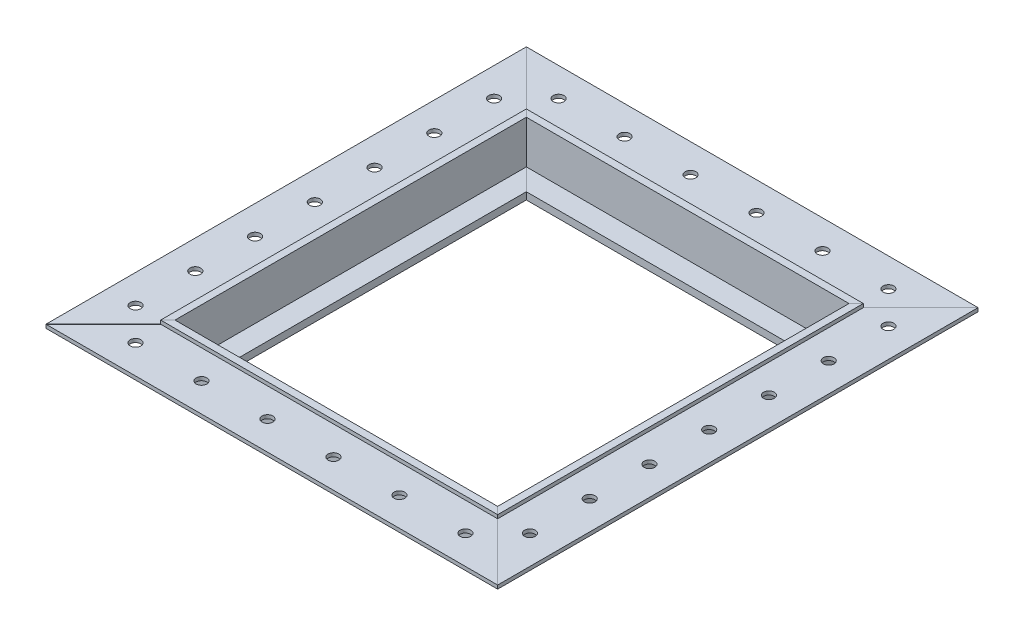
SolidWorks part; units mm, degrees
ref_plane "Front Plane" through (0, 0, 0) normal (0, 0, 1) x (1, 0, 0)
ref_plane "Top Plane" through (0, 0, 0) normal (0, 1, 0) x (1, 0, 0)
ref_plane "Right Plane" through (0, 0, 0) normal (1, 0, 0) x (0, 0, -1)
sketch "Sketch1" plane through (0, 0, 0) normal (0, 0, 1) x (1, 0, 0)
  line L0 (0, 0) -> (-12.7, 0)
  line L1 (-12.7, 0) -> (-12.7, 19.05)
  line L2 (-12.7, 19.05) -> (-38.1, 19.05)
  line L3 (-38.1, 19.05) -> (-38.1, 20.6375)
  line L4 (-38.1, 20.6375) -> (-12.7, 20.6375)
  line L5 (-12.7, 20.6375) -> (-12.7, 22.225)
  line L6 (-12.7, 22.225) -> (-9.525, 22.225)
  line L7 (-9.525, 22.225) -> (-9.525, 3.175)
  line L8 (-9.525, 3.175) -> (0, 3.175)
  line L9 (0, 3.175) -> (0, 0)
  line L10 (0, 0) -> (0.1482, 0.0676)
  line L11 (-9.525, 22.225) -> (133.35, 22.225) construction
  line L12 (61.9125, 22.225) -> (61.9125, -3.6466) construction
  line L13 (123.825, 0) -> (123.6768, 0.0676)
  line L14 (123.825, 3.175) -> (123.825, 0)
  line L15 (133.35, 3.175) -> (123.825, 3.175)
  line L16 (133.35, 22.225) -> (133.35, 3.175)
  line L17 (136.525, 22.225) -> (133.35, 22.225)
  line L18 (136.525, 20.6375) -> (136.525, 22.225)
  line L19 (161.925, 20.6375) -> (136.525, 20.6375)
  line L20 (161.925, 19.05) -> (161.925, 20.6375)
  line L21 (136.525, 19.05) -> (161.925, 19.05)
  line L22 (136.525, 0) -> (136.525, 19.05)
  line L23 (123.825, 0) -> (136.525, 0)
  dimension "D1" = 12.7
  dimension "D2" = 19.05
  dimension "D3" = 25.4
  dimension "D4" = 1.5875
  dimension "D5" = 22.225
  dimension "D6" = 3.175
  dimension "D7" = 3.175
  dimension "D8" = 142.875
sketch "Sketch2" plane through (0, 0, 0) normal (0, 1, 0) x (1, 0, 0)
  line L0 (-9.525, 0) -> (133.35, 0) construction
  line L1 (150.8125, -47.625) -> (-26.9875, -47.625)
  line L2 (150.8125, -47.625) -> (150.8125, 47.625)
  line L3 (150.8125, 47.625) -> (-26.9875, 47.625)
  line L4 (-26.9875, -47.625) -> (-26.9875, 47.625)
  line L5 (150.8125, -47.625) -> (-26.9875, 47.625) construction
  line L6 (150.8125, 47.625) -> (-26.9875, -47.625) construction
  point P0 (61.9125, 0)
  dimension "D1" = 177.8
  dimension "D2" = 95.25
extrude "Boss-Extrude1" add sketch "Sketch1" along normal mid plane 155.575 contours L14 L23 L22 L21 L20 L19 L18 L17 L16 L15 | L0 L1 L2 L3 L4 L5 L6 L7 L8 L9
ref_plane "Plane2" through (61.9125, 0, 0) normal (-1, 0, 0) x (0, 0, 1)
sketch "Sketch3" plane through (61.9125, 0, 0) normal (-1, 0, 0) x (0, 0, 1)
  line L0 (-68.2625, 0) -> (-80.9625, 0)
  line L1 (-80.9625, 0) -> (-80.9625, 19.05)
  line L2 (-80.9625, 19.05) -> (-106.3625, 19.05)
  line L3 (-106.3625, 19.05) -> (-106.3625, 20.6375)
  line L4 (-106.3625, 20.6375) -> (-80.9625, 20.6375)
  line L5 (-80.9625, 20.6375) -> (-80.9625, 22.225)
  line L6 (-80.9625, 22.225) -> (-77.7875, 22.225)
  line L7 (-77.7875, 22.225) -> (-77.7875, 3.175)
  line L8 (-77.7875, 3.175) -> (-68.2625, 3.175)
  line L9 (-68.2625, 3.175) -> (-68.2625, 0)
  line L11 (0, 22.225) -> (0, -35.0713) construction
  line L12 (77.7875, 22.225) -> (-77.7875, 22.225) construction
  line L13 (68.2625, 0) -> (68.1143, 0.0676)
  line L14 (68.2625, 3.175) -> (68.2625, 0)
  line L15 (77.7875, 3.175) -> (68.2625, 3.175)
  line L16 (77.7875, 22.225) -> (77.7875, 3.175)
  line L17 (80.9625, 22.225) -> (77.7875, 22.225)
  line L18 (80.9625, 20.6375) -> (80.9625, 22.225)
  line L19 (106.3625, 20.6375) -> (80.9625, 20.6375)
  line L20 (106.3625, 19.05) -> (106.3625, 20.6375)
  line L21 (80.9625, 19.05) -> (106.3625, 19.05)
  line L22 (80.9625, 0) -> (80.9625, 19.05)
  line L23 (68.2625, 0) -> (80.9625, 0)
  dimension "D1" = 12.7
  dimension "D2" = 19.05
  dimension "D3" = 25.4
  dimension "D4" = 1.5875
  dimension "D5" = 22.225
  dimension "D6" = 3.175
  dimension "D7" = 3.175
  dimension "D8" = 77.7875
extrude "Boss-Extrude2" add sketch "Sketch3" along normal mid plane 200.025 contours L9 L8 L7 L6 L5 L4 L3 L2 L1 L0 | L14 L23 L22 L21 L20 L19 L18 L17 L16 L15
sketch "Sketch4" plane through (0, 20.6375, 0) normal (0, 1, 0) x (1, 0, 0)
  line L0 (-38.1, -106.3625) -> (161.925, -106.3625) construction
  line L1 (161.925, 106.3625) -> (136.525, 106.3625)
  line L2 (161.925, 106.3625) -> (161.925, -106.3625)
  line L3 (161.925, -106.3625) -> (136.525, -106.3625)
  line L4 (136.525, 106.3625) -> (136.525, -106.3625)
  line L5 (-38.1, 106.3625) -> (161.925, 106.3625) construction
  line L6 (-38.1, -106.3625) -> (-12.7, -106.3625)
  line L7 (-38.1, -106.3625) -> (-38.1, 106.3625)
  line L8 (-38.1, 106.3625) -> (-12.7, 106.3625)
  line L9 (-12.7, -106.3625) -> (-12.7, 106.3625)
  line L10 (136.525, -77.7875) -> (136.525, 77.7875) construction
  line L11 (161.925, -77.7875) -> (161.925, 77.7875) construction
  line L12 (-38.1, -106.3625) -> (161.925, -106.3625) construction
  line L13 (-12.7, -77.7875) -> (-12.7, 77.7875) construction
  line L14 (-38.1, 106.3625) -> (161.925, 106.3625) construction
  line L15 (-38.1, -77.7875) -> (-38.1, 77.7875) construction
extrude "Cut-Extrude1" cut sketch "Sketch4" along normal blind 158.75
sketch "Sketch5" plane through (0, 0, 80.9625) normal (0, 0, 1) x (1, 0, 0)
  line L1 (-38.1, 19.05) -> (-12.7, 19.05)
  line L2 (-38.1, 19.05) -> (-38.1, 0)
  line L3 (-38.1, 0) -> (-12.7, 0)
  line L4 (-12.7, 19.05) -> (-12.7, 0)
  line L5 (136.525, 0) -> (161.925, 0)
  line L6 (136.525, 0) -> (136.525, 19.05)
  line L7 (136.525, 19.05) -> (161.925, 19.05)
  line L8 (161.925, 0) -> (161.925, 19.05)
extrude "Cut-Extrude2" cut sketch "Sketch5" against normal through all
sketch "Sketch14" plane through (0, 22.225, 0) normal (0, 1, 0) x (1, 0, 0)
  line L0 (-9.525, -77.7875) -> (133.35, -77.7875) construction
  line L1 (133.35, -77.7875) -> (133.35, 77.7875) construction
  line L2 (-9.525, 77.7875) -> (133.35, 77.7875) construction
  line L3 (-9.525, -77.7875) -> (-9.525, 77.7875) construction
  line L4 (-12.7, 80.9625) -> (-12.7, -80.9625)
  line L5 (-12.7, -80.9625) -> (136.525, -80.9625)
  line L6 (136.525, -80.9625) -> (136.525, 80.9625)
  line L7 (136.525, 80.9625) -> (-12.7, 80.9625)
  line L8 (-12.7, 80.9625) -> (-12.7, -80.9625)
  line L9 (-12.7, -80.9625) -> (136.525, -80.9625)
  line L10 (136.525, -80.9625) -> (136.525, 80.9625)
  line L11 (136.525, 80.9625) -> (-12.7, 80.9625)
  line L12 (-9.525, -77.7875) -> (133.35, -77.7875)
  line L13 (133.35, -77.7875) -> (133.35, 77.7875)
  line L14 (-9.525, 77.7875) -> (133.35, 77.7875)
  line L15 (-9.525, -77.7875) -> (-9.525, 77.7875)
  line L16 (-11.1125, -79.375) -> (-11.1125, 79.375)
  line L17 (-11.1125, 79.375) -> (134.9375, 79.375)
  line L18 (134.9375, -79.375) -> (134.9375, 79.375)
  line L19 (-11.1125, -79.375) -> (134.9375, -79.375)
  dimension "D2" = 1.5875
  dimension "D1" = 0
sketch "Sketch6" plane through (0, 22.225, 0) normal (0, 1, 0) x (1, 0, 0)
  line L0 (161.925, 106.3625) -> (123.825, 68.2625) construction
  line L1 (0, 0) -> (186.3821, 0) construction
  line L2 (61.9125, 106.3625) -> (61.9125, 211.7305) construction
  line L3 (-38.1, 106.3625) -> (161.925, 106.3625) construction
  line L4 (161.907, 106.3805) -> (114.639, 59.1124)
  line L5 (161.943, 106.3445) -> (115.0327, 59.4343)
  line L6 (114.639, 59.1124) -> (115.0327, 59.4343)
  line L7 (161.907, 106.3805) -> (123.807, 68.2805) construction
  line L8 (161.943, 106.3445) -> (123.843, 68.2445) construction
  line L9 (161.907, 106.3805) -> (161.943, 106.3445)
  line L10 (-38.1, 106.3625) -> (0, 68.2625) construction
  line L11 (-38.082, 106.3805) -> (-38.118, 106.3445)
  line L12 (9.186, 59.1124) -> (8.7923, 59.4343)
  line L13 (-38.118, 106.3445) -> (8.7923, 59.4343)
  line L14 (-38.082, 106.3805) -> (9.186, 59.1124)
  line L15 (-38.1, -106.3625) -> (0, -68.2625) construction
  line L16 (61.9125, -106.3625) -> (61.9125, -211.7305) construction
  line L17 (161.925, -106.3625) -> (123.825, -68.2625) construction
  line L18 (-38.082, -106.3805) -> (9.186, -59.1124)
  line L19 (-38.118, -106.3445) -> (8.7923, -59.4343)
  line L20 (9.186, -59.1124) -> (8.7923, -59.4343)
  line L21 (-38.082, -106.3805) -> (-38.118, -106.3445)
  line L22 (161.907, -106.3805) -> (161.943, -106.3445)
  line L23 (114.639, -59.1124) -> (115.0327, -59.4343)
  line L24 (161.943, -106.3445) -> (115.0327, -59.4343)
  line L25 (161.907, -106.3805) -> (114.639, -59.1124)
  dimension "D3" = 1.27
  dimension "D4" = 0.5085
  dimension "D1" = 0.0254
  dimension "D2" = 0.0254
extrude "Cut-Extrude3" cut sketch "Sketch6" against normal through all
sketch "Sketch7" plane through (0, 20.6375, 0) normal (0, 1, 0) x (1, 0, 0)
  line L0 (-38.1, 106.3266) -> (-38.1, 106.3625) construction
  line L1 (-38.1, 106.3625) -> (-38.0641, 106.3625) construction
  line L2 (161.8891, -106.3625) -> (161.925, -106.3625) construction
  line L3 (161.925, -106.3266) -> (161.925, -106.3625) construction
  line L4 (149.225, 93.6625) -> (-25.4, 93.6625) construction
  line L5 (161.925, -106.3625) -> (-38.1, -106.3625) construction
  line L6 (161.925, -106.3625) -> (161.925, 106.3625) construction
  line L7 (161.925, 106.3625) -> (-38.1, 106.3625) construction
  line L8 (-38.1, -106.3625) -> (-38.1, 106.3625) construction
  line L9 (-25.4, -93.6625) -> (-25.4, 93.6625) construction
  line L10 (149.225, -93.6625) -> (-25.4, -93.6625) construction
  line L11 (149.225, -93.6625) -> (149.225, 93.6625) construction
  line L12 (-12.7, 75.2116) -> (-9.525, 75.2116) construction
  line L13 (-12.7, -80.9266) -> (-12.7, 80.9266) construction
  line L14 (-9.525, -77.7516) -> (-9.525, 77.7516) construction
  line L15 (-6.9491, 80.9625) -> (-6.9491, 77.7875) construction
  line L16 (-12.6641, 80.9625) -> (136.4891, 80.9625) construction
  line L17 (133.3141, 77.7875) -> (-9.4891, 77.7875) construction
  line L18 (61.9125, 106.3625) -> (61.9125, -106.3625) construction
  line L19 (-38.1, 0) -> (161.925, 0) construction
  line L20 (-11.1125, 75.2116) -> (-11.1125, 93.6625) construction
  line L21 (-6.9491, 79.375) -> (-25.4, 79.375) construction
  line L22 (130.7741, 80.9625) -> (130.7741, 77.7875) construction
  line L23 (136.525, 75.2116) -> (133.35, 75.2116) construction
  line L24 (130.7741, 79.375) -> (149.225, 79.375) construction
  line L25 (134.9375, 75.2116) -> (134.9375, 93.6625) construction
  circle A0 centre (-11.1125, 93.6625) radius 2.3749 construction
  circle A1 centre (-25.4, 79.375) radius 2.3813
  dimension "D4" = 4.7498
  dimension "D5" = 4.7625
  dimension "D6" = 146.05
  dimension "D2" = 2.54
  dimension "D3" = 2.54
  dimension "D1" = 12.7
extrude "Cut-Extrude4" cut sketch "Sketch7" against normal blind 2.54
pattern_linear "LPattern1" count 7 spacing 26.4583 along (0, 0, 1) of "Cut-Extrude4"
sketch "Sketch8" plane through (0, 20.6375, 0) normal (0, 1, 0) x (1, 0, 0)
  circle A0 centre (-11.1125, 93.6625) radius 2.3749
extrude "Cut-Extrude5" cut sketch "Sketch8" against normal blind 2.54
pattern_linear "LPattern2" count 6 spacing 29.21 along (1, 0, 0) of "Cut-Extrude5"
ref_plane "Plane3" through (0, 0, 0) normal (0, 0, -1) x (-1, 0, 0)
sketch "Sketch9" plane through (0, 20.6375, 0) normal (0, 1, 0) x (1, 0, 0)
  line L0 (61.9125, 106.3625) -> (61.9125, -106.3625) construction
  line L3 (-38.0641, 106.3625) -> (161.8891, 106.3625) construction
  line L6 (-38.0641, -106.3625) -> (161.8891, -106.3625) construction
  line L7 (-38.1, 0) -> (161.925, 0) construction
  line L8 (-38.1, 106.3266) -> (-38.1, -106.3266) construction
  line L9 (161.925, -106.3266) -> (161.925, 106.3266) construction
  circle A5 centre (134.9375, 93.6625) radius 2.3749 construction
  circle A6 centre (105.7275, 93.6625) radius 2.3749 construction
  circle A7 centre (76.5175, 93.6625) radius 2.3749 construction
  circle A8 centre (47.3075, 93.6625) radius 2.3749 construction
  circle A9 centre (18.0975, 93.6625) radius 2.3749 construction
  circle A18 centre (-11.1125, 93.6625) radius 2.3749 construction
  circle A19 centre (134.9375, 93.6625) radius 2.3749 construction
  circle A20 centre (105.7275, 93.6625) radius 2.3749 construction
  circle A21 centre (76.5175, 93.6625) radius 2.3749 construction
  circle A22 centre (47.3075, 93.6625) radius 2.3749 construction
  circle A23 centre (18.0975, 93.6625) radius 2.3749 construction
  circle A24 centre (-11.1125, 93.6625) radius 2.3749 construction
  circle A25 centre (-11.1125, -93.6625) radius 2.3749
  circle A26 centre (18.0975, -93.6625) radius 2.3749
  circle A27 centre (47.3075, -93.6625) radius 2.3749
  circle A28 centre (76.5175, -93.6625) radius 2.3749
  circle A29 centre (105.7275, -93.6625) radius 2.3749
  circle A30 centre (134.9375, -93.6625) radius 2.3749
  circle A31 centre (-25.4, -79.375) radius 2.3813 construction
  circle A32 centre (-25.4, -52.9167) radius 2.3813 construction
  circle A33 centre (-25.4, -26.4583) radius 2.3813 construction
  circle A34 centre (-25.4, 0) radius 2.3813 construction
  circle A35 centre (-25.4, 26.4583) radius 2.3813 construction
  circle A36 centre (-25.4, 52.9167) radius 2.3813 construction
  circle A37 centre (-25.4, 79.375) radius 2.3813 construction
  circle A38 centre (-25.4, -79.375) radius 2.3813 construction
  circle A39 centre (-25.4, -52.9167) radius 2.3813 construction
  circle A40 centre (-25.4, -26.4583) radius 2.3813 construction
  circle A41 centre (-25.4, 0) radius 2.3813 construction
  circle A42 centre (-25.4, 26.4583) radius 2.3813 construction
  circle A43 centre (-25.4, 52.9167) radius 2.3813 construction
  circle A44 centre (-25.4, 79.375) radius 2.3813 construction
  circle A45 centre (149.225, 79.375) radius 2.3813
  circle A46 centre (149.225, 52.9167) radius 2.3813
  circle A47 centre (149.225, 26.4583) radius 2.3813
  circle A48 centre (149.225, 0) radius 2.3812
  circle A49 centre (149.225, -26.4583) radius 2.3812
  circle A50 centre (149.225, -52.9167) radius 2.3812
  circle A51 centre (149.225, -79.375) radius 2.3813
extrude "Cut-Extrude6" cut sketch "Sketch9" against normal blind 2.54
sketch "Sketch16" plane through (0, 3.175, 0) normal (0, 1, 0) x (1, 0, 0)
  line L0 (-9.4891, -77.7875) -> (133.3141, -77.7875) construction
  line L1 (-9.525, -77.7516) -> (-9.525, 77.7516) construction
  circle A0 centre (-3.9688, 72.2312) radius 1.5875 construction
  circle A1 centre (-3.9688, 72.2312) radius 1.5875
  circle A2 centre (127.7937, 72.2312) radius 1.5875 construction
  circle A3 centre (127.7937, 72.2312) radius 1.5875
  circle A4 centre (127.7937, -72.2312) radius 1.5875 construction
  circle A5 centre (127.7937, -72.2312) radius 1.5875
  circle A7 centre (-3.9688, -72.2312) radius 1.5875
  circle A8 centre (-3.9688, 37.3062) radius 1.5875 construction
  circle A9 centre (-3.9688, 37.3062) radius 1.5875
  circle A10 centre (-3.9688, -37.3062) radius 1.5875 construction
  circle A11 centre (-3.9688, -37.3062) radius 1.5875
  circle A12 centre (127.7937, -37.3062) radius 1.5875 construction
  circle A13 centre (127.7937, -37.3062) radius 1.5875
  circle A14 centre (127.7937, 37.3062) radius 1.5875 construction
  circle A15 centre (127.7937, 37.3062) radius 1.5875
  dimension "D1" = 5.5563
  dimension "D3" = 3.175
  dimension "D2" = 5.5562
